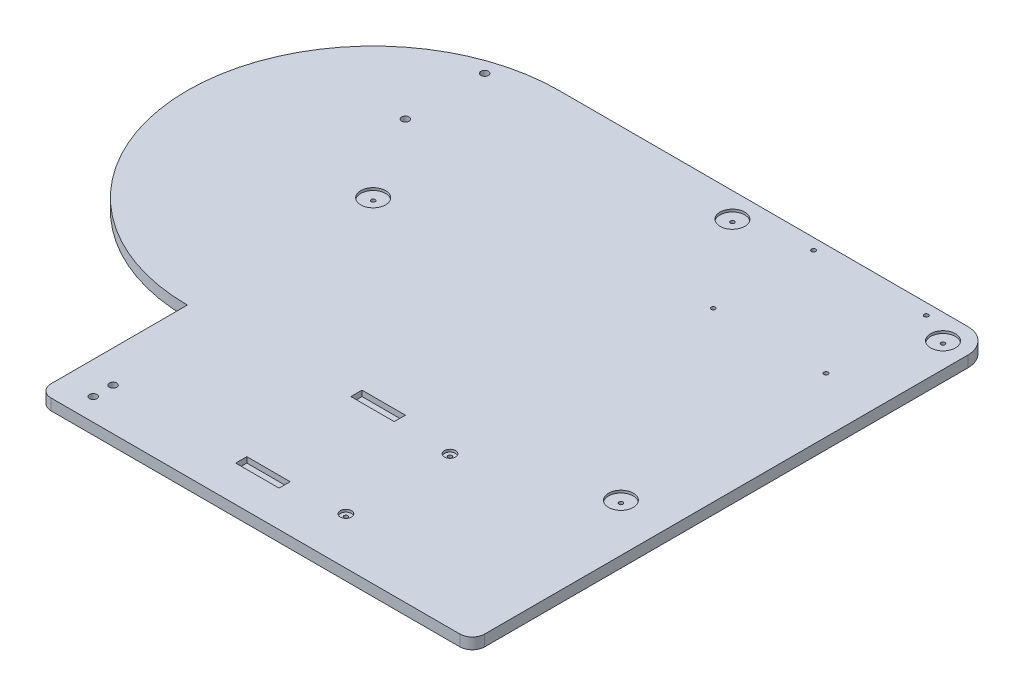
SolidWorks part; units mm, degrees
ref_plane "Front Plane" through (0, 0, 0) normal (0, 0, 1) x (1, 0, 0)
ref_plane "Top Plane" through (0, 0, 0) normal (0, 1, 0) x (1, 0, 0)
ref_plane "Right Plane" through (0, 0, 0) normal (1, 0, 0) x (0, 0, -1)
body saved out of another part "Stock-V1-1"
move or copy body "Body-Move/Copy1" bodies to move or copy 101 copy no rotation origin (75, 0, -60) rotation axis (0, 1, 0) rotation angle 180
